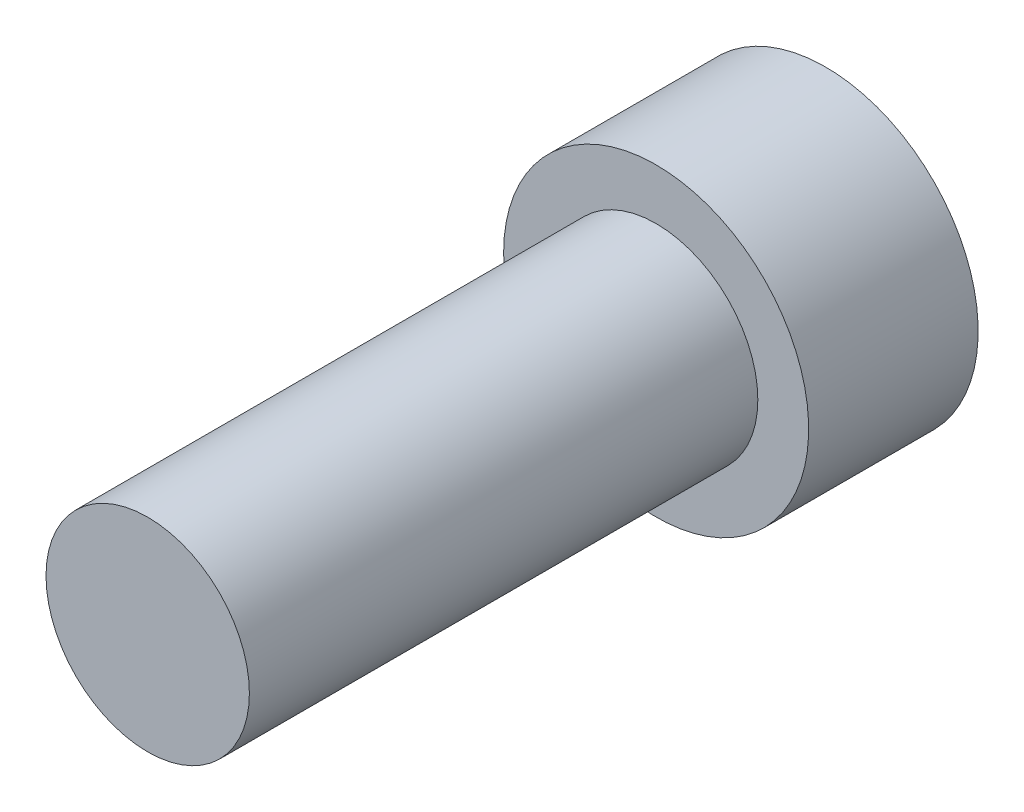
SolidWorks part; units mm, degrees
ref_plane "Plane1" through (0, 0, 0) normal (0, 0, 1) x (1, 0, 0)
ref_plane "Plane2" through (0, 0, 0) normal (0, 1, 0) x (1, 0, 0)
ref_plane "Plane3" through (0, 0, 0) normal (1, 0, 0) x (0, 0, -1)
sketch "Esquisse1" plane through (0, 0, 0) normal (0, 0, 1) x (1, 0, 0)
  circle A0 centre (0, 0) radius 3
  dimension "D1" = 6
extrude "Base-Extrusion" add sketch "Esquisse1" along normal blind 15
sketch "Esquisse2" plane through (0, 0, 0) normal (0, 0, -1) x (-1, 0, 0)
  circle A0 centre (0, 0) radius 4.5
  dimension "D1" = 9
extrude "Boss.-Extru.1" add sketch "Esquisse2" along normal blind 5
sketch "Esquisse3" plane through (0, 0, -5) normal (0, 0, -1) x (-1, 0, 0)
  line L0 (3, 1.7321) -> (0, 0)
  line L1 (0, 0) -> (3, -1.7321)
  line L5 (3, 1.7321) -> (3, -1.7321)
  dimension "D1" = 3
  dimension "D2" = 3.4641
  dimension "D3" = 60
extrude "Enlèv. mat.-Extru.3" cut sketch "Esquisse3" against normal blind 4
pattern_circular "Répétition circulaire1" count 7 every 60
